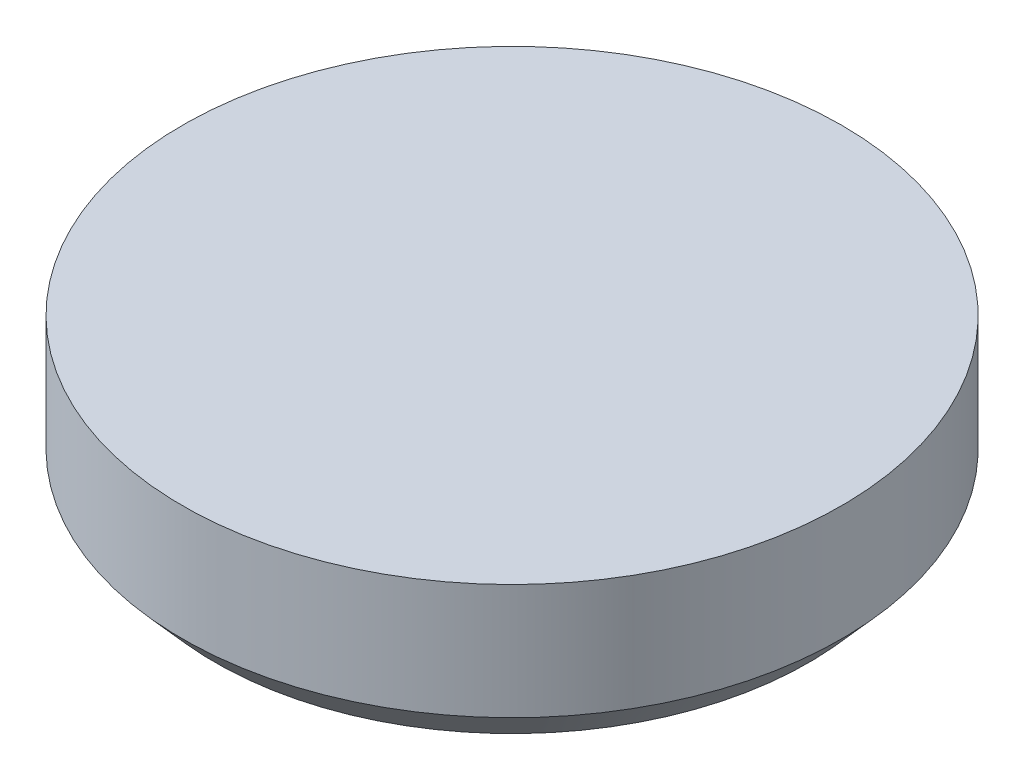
SolidWorks part; units mm, degrees
ref_plane "前视基准面" through (0, 0, 0) normal (0, 0, 1) x (1, 0, 0)
ref_plane "上视基准面" through (0, 0, 0) normal (0, 1, 0) x (1, 0, 0)
ref_plane "右视基准面" through (0, 0, 0) normal (1, 0, 0) x (0, 0, -1)
sketch "草图1" plane through (0, 0, 0) normal (0, 0, 1) x (1, 0, 0)
  line L0 (0, 0) -> (0, 528.9135) construction
  line L1 (0, 370) -> (800, 370)
  line L2 (800, 370) -> (800, 90)
  line L3 (800, 90) -> (720, 0)
  line L4 (720, 0) -> (0, 0)
  line L5 (0, 0) -> (0, 370)
  dimension "D1" = 280
  dimension "D2" = 90
  dimension "D3" = 1600
  dimension "D4" = 1440
revolve "旋转1" add sketch "草图1" angle 360 about L0
